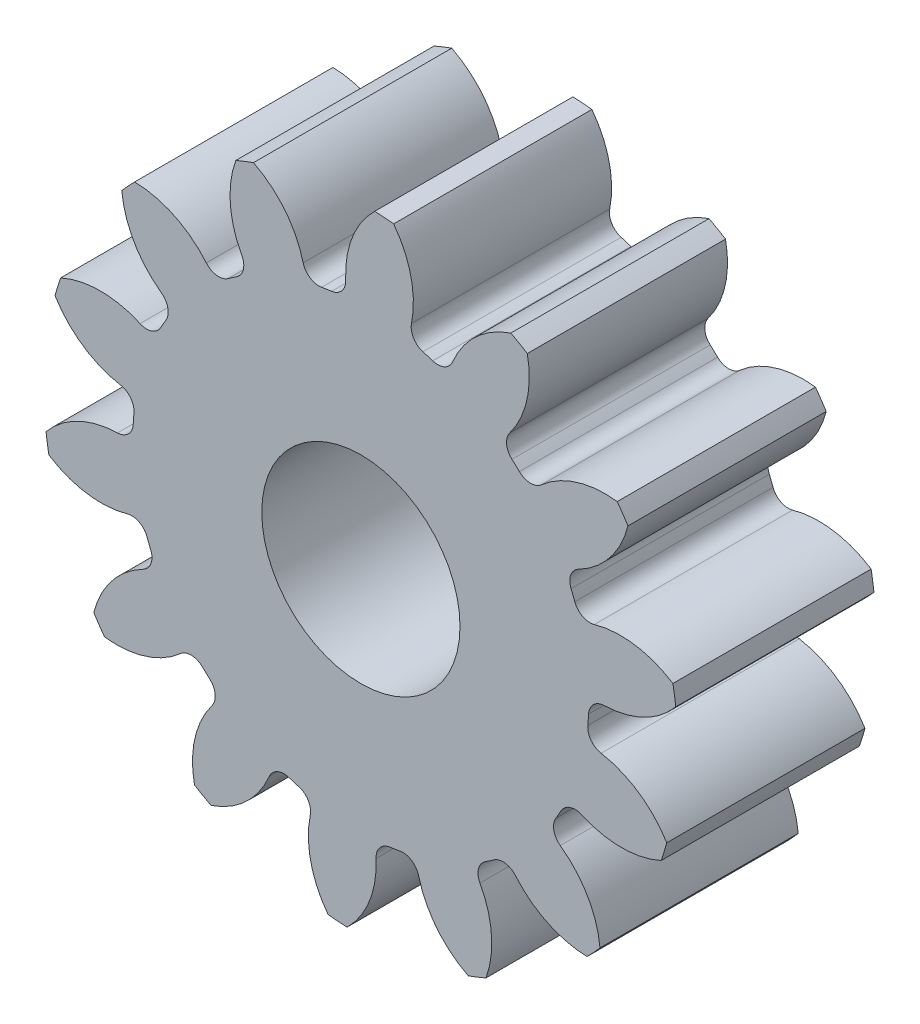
SolidWorks part; units mm, degrees
ref_plane "Front" through (0, 0, 0) normal (0, 0, 1) x (1, 0, 0)
ref_plane "Top" through (0, 0, 0) normal (0, 1, 0) x (1, 0, 0)
ref_plane "Right" through (0, 0, 0) normal (1, 0, 0) x (0, 0, -1)
sketch "Sketch3" plane through (0, 0, 0) normal (0, 0, 1) x (1, 0, 0)
  circle A0 centre (0, 0) radius 162.56
  dimension "od" = 325.12
extrude "gearBody" add sketch "Sketch3" along normal blind 101.6
sketch "Sketch2" plane through (0, 0, 0) normal (0, 0, 1) x (1, 0, 0)
  line L0 (0, 0) -> (123.4875, 51.1502) construction
  line L1 (157.7152, -44.677) -> (0, 0) construction
  line L2 (0, 0) -> (36.3143, 0) construction
  line L3 (142.1333, 5.5081) -> (139.7913, -26.2793) construction
  line L5 (140.9623, -10.3856) -> (0, 0) construction
  line L7 (0, 0) -> (133.6619, 0) construction
  arc A0 (133.6304, 2.901) -> (131.7623, -22.4542) centre (0, 0) ccw construction
  arc A1 (161.3742, 19.5993) -> (156.7593, -43.0382) centre (0, 0) ccw construction
  arc A2 (142.1333, 5.5081) -> (139.7913, -26.2793) centre (0, 0) ccw construction
  arc A3 (116.3035, -11.1839) -> (116.6868, -5.9819) centre (0, 0) ccw
  arc A4 (157.7152, -44.677) -> (123.1168, -20.1232) centre (114.6577, -68.6959) ccw
  arc A5 (157.7152, -44.677) -> (162.56, 21.0803) centre (0, 0) ccw
  arc A6 (162.56, 21.0803) -> (124.7366, 1.8622) centre (123.4875, 51.1502) cw
  arc A7 (116.6868, -5.9819) -> (124.7366, 1.8622) centre (124.9462, -6.4054) cw
  arc A8 (123.1168, -20.1232) -> (116.3035, -11.1839) centre (124.5358, -11.9756) cw
  point P6 (162.56, 21.0803)
  point P22 (157.7152, -44.677)
  dimension "baseDia" = 267.3238
  dimension "od" = 325.12
  dimension "pd" = 284.48
  dimension "rd" = 233.68
  dimension "rFillet" = 8.2702
  dimension "pointX" = 162.56
  dimension "pointY" = 21.0803
  dimension "CTT" = 31.7875
  dimension "flankCenterAngle" = 22.5
extrude "toothCut" cut sketch "Sketch2" along normal through all
pattern_circular "CirPattern1" count 14 over 360 about axis through (0, 0, 0) along (0, 0, 1) of "toothCut"
sketch "hub1Dia" plane through (0, 0, 0) normal (0, 0, -1) x (-1, 0, 0)
  circle A0 centre (0, 0) radius 12.7
  dimension "hub1Dia" = 25.4
sketch "hub2Dia" plane through (0, 0, 101.6) normal (0, 0, 1) x (1, 0, 0)
  circle A0 centre (0, 0) radius 12.7
  dimension "hub2dia" = 25.4
sketch "boreDia" plane through (0, 0, 0) normal (0, 0, 1) x (1, 0, 0)
  circle A0 centre (0, 0) radius 50.8
  dimension "boreDia" = 101.6
extrude "bore" cut sketch "boreDia" against normal mid plane 25400
